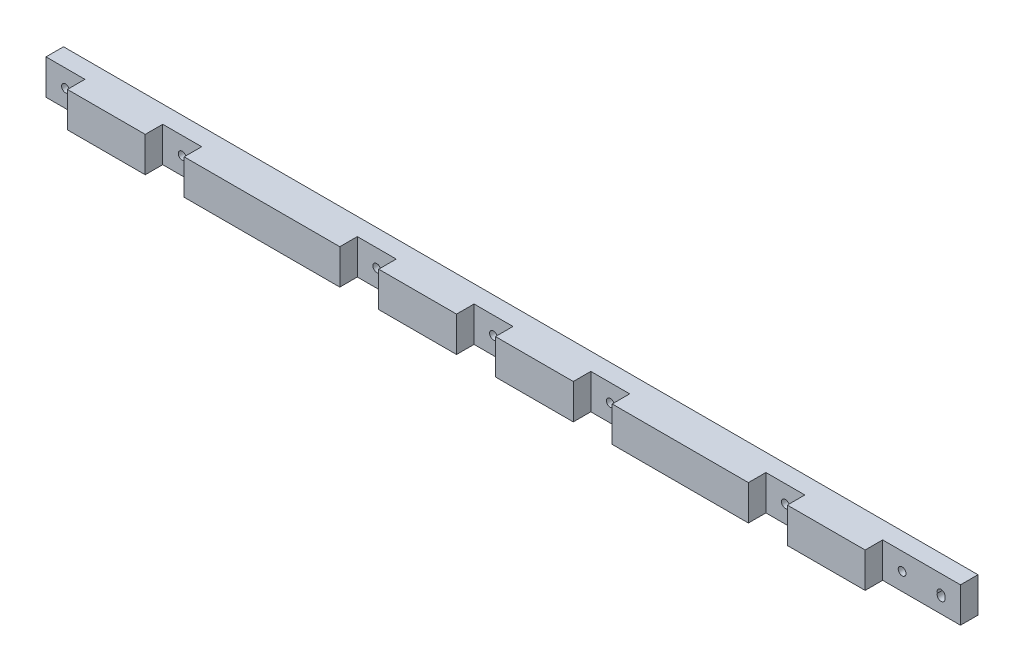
SolidWorks part; units mm, degrees
ref_plane "Plan de face" through (0, 0, 0) normal (0, 0, 1) x (1, 0, 0)
ref_plane "Plan de dessus" through (0, 0, 0) normal (0, 1, 0) x (1, 0, 0)
ref_plane "Plan de droite" through (0, 0, 0) normal (1, 0, 0) x (0, 0, -1)
sketch "Esquisse1" plane through (0, 0, 0) normal (0, 0, 1) x (1, 0, 0)
  line L1 (0, 0) -> (235, 0)
  line L2 (0, 0) -> (0, 9)
  line L3 (0, 9) -> (235, 9)
  line L4 (235, 0) -> (235, 9)
  dimension "D1" = 235
  dimension "D2" = 9
extrude "Extrusion1" add sketch "Esquisse1" along normal blind 9
sketch "Esquisse2" plane through (0, 0, 9) normal (0, 0, 1) x (1, 0, 0)
  line L0 (235, 9) -> (0, 9) construction
  line L1 (0, 0) -> (10, 0)
  line L2 (0, 0) -> (0, 9)
  line L3 (0, 9) -> (10, 9)
  line L4 (10, 0) -> (10, 9)
  dimension "D1" = 10
extrude "Enlèv. mat.-Extru.1" cut sketch "Esquisse2" against normal blind 4.5
sketch "Esquisse3" plane through (0, 0, 4.5) normal (0, 0, 1) x (1, 0, 0)
  line L0 (0, 9) -> (0, 0) construction
  line L1 (0, 0) -> (10, 0) construction
  circle A0 centre (5, 4.5) radius 1
  dimension "D3" = 2
  dimension "D1" = 5
  dimension "D2" = 4.5
extrude "Enlèv. mat.-Extru.2" cut sketch "Esquisse3" against normal blind 4.5
sketch "Esquisse4" plane through (0, 0, 9) normal (0, 0, 1) x (1, 0, 0)
  line L0 (10, 0) -> (235, 0) construction
  line L1 (30, 0) -> (40, 0)
  line L2 (30, 0) -> (30, 9)
  line L3 (30, 9) -> (40, 9)
  line L4 (40, 0) -> (40, 9)
  line L5 (235, 9) -> (10, 9) construction
  dimension "D1" = 10
  dimension "D2" = 20
extrude "Enlèv. mat.-Extru.3" cut sketch "Esquisse4" against normal blind 4.5
sketch "Esquisse5" plane through (0, 0, 4.5) normal (0, 0, 1) x (1, 0, 0)
  line L0 (30, 9) -> (30, 0) construction
  line L1 (30, 0) -> (40, 0) construction
  circle A0 centre (35, 4.5) radius 1
  dimension "D3" = 2
  dimension "D1" = 5
  dimension "D2" = 4.5
extrude "Enlèv. mat.-Extru.4" cut sketch "Esquisse5" against normal blind 4.5
sketch "Esquisse6" plane through (0, 0, 9) normal (0, 0, 1) x (1, 0, 0)
  line L0 (235, 9) -> (40, 9) construction
  line L1 (80, 9) -> (90, 9)
  line L2 (80, 9) -> (80, 0)
  line L3 (80, 0) -> (90, 0)
  line L4 (90, 9) -> (90, 0)
  line L5 (40, 0) -> (235, 0) construction
  dimension "D1" = 10
  dimension "D2" = 40
extrude "Enlèv. mat.-Extru.5" cut sketch "Esquisse6" against normal blind 4.5
sketch "Esquisse7" plane through (0, 0, 4.5) normal (0, 0, 1) x (1, 0, 0)
  line L0 (80, 9) -> (80, 0) construction
  line L1 (80, 0) -> (90, 0) construction
  circle A0 centre (85, 4.5) radius 1
  dimension "D3" = 2
  dimension "D1" = 5
  dimension "D2" = 4.5
extrude "Enlèv. mat.-Extru.6" cut sketch "Esquisse7" against normal blind 4.5
sketch "Esquisse8" plane through (0, 0, 9) normal (0, 0, 1) x (1, 0, 0)
  line L0 (90, 0) -> (235, 0) construction
  line L1 (110, 0) -> (120, 0)
  line L2 (110, 0) -> (110, 9)
  line L3 (110, 9) -> (120, 9)
  line L4 (120, 0) -> (120, 9)
  line L5 (235, 9) -> (90, 9) construction
  dimension "D1" = 10
  dimension "D2" = 20
extrude "Enlèv. mat.-Extru.7" cut sketch "Esquisse8" against normal blind 4.5
sketch "Esquisse9" plane through (0, 0, 4.5) normal (0, 0, 1) x (1, 0, 0)
  line L0 (110, 9) -> (110, 0) construction
  line L1 (120, 9) -> (110, 9) construction
  circle A0 centre (115, 4.5) radius 1
  dimension "D3" = 2
  dimension "D1" = 5
  dimension "D2" = 4.5
extrude "Enlèv. mat.-Extru.8" cut sketch "Esquisse9" against normal blind 4.5
sketch "Esquisse10" plane through (0, 0, 9) normal (0, 0, 1) x (1, 0, 0)
  line L0 (120, 0) -> (235, 0) construction
  line L1 (140, 0) -> (150, 0)
  line L2 (140, 0) -> (140, 9)
  line L3 (140, 9) -> (150, 9)
  line L4 (150, 0) -> (150, 9)
  line L5 (235, 9) -> (120, 9) construction
  dimension "D1" = 10
  dimension "D2" = 20
extrude "Enlèv. mat.-Extru.9" cut sketch "Esquisse10" against normal blind 4.5
sketch "Esquisse11" plane through (0, 0, 4.5) normal (0, 0, 1) x (1, 0, 0)
  line L0 (140, 9) -> (140, 0) construction
  line L1 (140, 0) -> (150, 0) construction
  circle A0 centre (145, 4.5) radius 1
  dimension "D3" = 2
  dimension "D1" = 5
  dimension "D2" = 4.5
extrude "Enlèv. mat.-Extru.10" cut sketch "Esquisse11" against normal blind 4.5
sketch "Esquisse12" plane through (0, 0, 9) normal (0, 0, 1) x (1, 0, 0)
  line L0 (150, 0) -> (235, 0) construction
  line L1 (185, 0) -> (195, 0)
  line L2 (185, 0) -> (185, 9)
  line L3 (185, 9) -> (195, 9)
  line L4 (195, 0) -> (195, 9)
  line L5 (235, 9) -> (150, 9) construction
  dimension "D1" = 10
  dimension "D2" = 35
extrude "Enlèv. mat.-Extru.11" cut sketch "Esquisse12" against normal blind 4.5
sketch "Esquisse13" plane through (0, 0, 4.5) normal (0, 0, 1) x (1, 0, 0)
  line L0 (185, 9) -> (185, 0) construction
  line L1 (185, 0) -> (195, 0) construction
  circle A0 centre (190, 4.5) radius 1
  dimension "D3" = 2
  dimension "D1" = 5
  dimension "D2" = 4.5
extrude "Enlèv. mat.-Extru.12" cut sketch "Esquisse13" against normal blind 4.5
sketch "Esquisse14" plane through (0, 0, 9) normal (0, 0, 1) x (1, 0, 0)
  line L0 (195, 0) -> (235, 0) construction
  line L1 (215, 0) -> (225, 0)
  line L2 (215, 0) -> (215, 9)
  line L3 (215, 9) -> (225, 9)
  line L4 (225, 0) -> (225, 9)
  line L5 (235, 9) -> (195, 9) construction
  dimension "D1" = 10
  dimension "D2" = 20
extrude "Enlèv. mat.-Extru.13" cut sketch "Esquisse14" against normal blind 4.5
sketch "Esquisse15" plane through (0, 0, 4.5) normal (0, 0, 1) x (1, 0, 0)
  line L0 (215, 9) -> (215, 0) construction
  line L1 (225, 9) -> (215, 9) construction
  circle A0 centre (220, 4.5) radius 1
  dimension "D3" = 2
  dimension "D1" = 5
  dimension "D2" = 4.5
extrude "Enlèv. mat.-Extru.14" cut sketch "Esquisse15" against normal blind 4.5
sketch "Esquisse17" plane through (0, 0, 9) normal (0, 0, 1) x (1, 0, 0)
  line L1 (225, 0) -> (235, 0)
  line L2 (225, 0) -> (225, 9)
  line L3 (225, 9) -> (235, 9)
  line L4 (235, 0) -> (235, 9)
  dimension "D1" = 10
extrude "Enlèv. mat.-Extru.15" cut sketch "Esquisse17" against normal blind 4.5
sketch "Esquisse18" plane through (0, 0, 4.5) normal (0, 0, 1) x (1, 0, 0)
  line L0 (235, 0) -> (235, 9) construction
  circle A0 centre (230, 3.8158) radius 1
  dimension "D2" = 2
  dimension "D1" = 5
sketch "Esquisse20" plane through (0, 0, 4.5) normal (0, 0, 1) x (1, 0, 0)
  line L0 (235, 0) -> (235, 9) construction
  line L1 (215, 0) -> (235, 0) construction
  circle A0 centre (230, 4.5) radius 1
  dimension "D3" = 2
  dimension "D1" = 5
  dimension "D2" = 4.5
extrude "Enlèv. mat.-Extru.17" cut sketch "Esquisse20" against normal blind 4.5
extrude "Enlèv. mat.-Extru.16" cut sketch "Esquisse18" against normal blind 4.5
